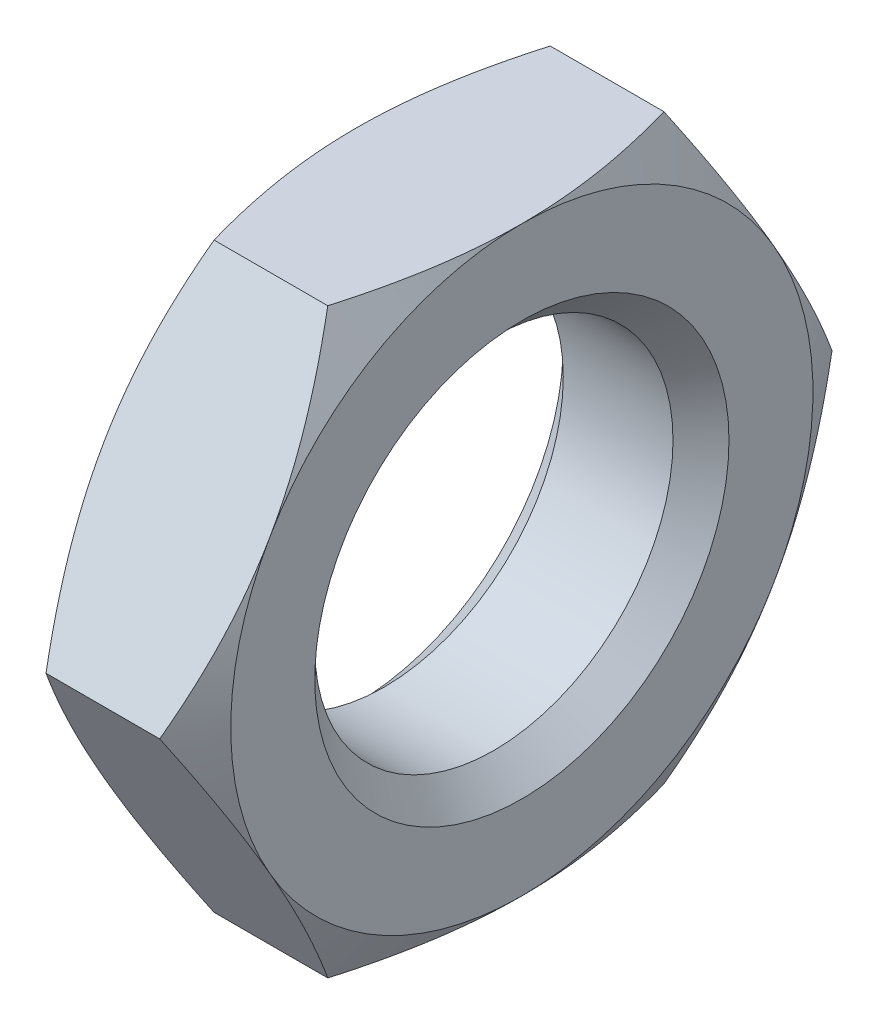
SolidWorks part; units mm, degrees
ref_plane "Front Plane" through (0, 0, 0) normal (0, 0, 1) x (1, 0, 0)
ref_plane "Top Plane" through (0, 0, 0) normal (0, 1, 0) x (1, 0, 0)
ref_plane "Right Plane" through (0, 0, 0) normal (1, 0, 0) x (0, 0, -1)
sketch "Sketch1" plane through (0, 0, 0) normal (1, 0, 0) x (0, 0, -1)
  line L1 (3.7528, 6.5) -> (-3.7528, 6.5)
  line L2 (-3.7528, 6.5) -> (-7.5056, 0)
  line L3 (-7.5056, 0) -> (-3.7528, -6.5)
  line L4 (-3.7528, -6.5) -> (3.7528, -6.5)
  line L5 (3.7528, -6.5) -> (7.5056, 0)
  line L6 (7.5056, 0) -> (3.7528, 6.5)
  circle A0 centre (0, 0) radius 6.5 construction
  circle A1 centre (0, 0) radius 4
extrude "Extrude1" add sketch "Sketch1" along normal blind 3.7
sketch "Sketch2" plane through (0, 0, 0) normal (0, 0, 1) x (1, 0, 0)
  line L0 (3.7, 6.5) -> (3.7, 26)
  line L1 (3.7, 26) -> (0, 26)
  line L2 (0, 26) -> (0, 6.5)
  line L3 (0, 6.5) -> (1.85, 9.7043)
  line L4 (1.85, 9.7043) -> (3.7, 6.5)
revolve "Cut-Revolve1" cut sketch "Sketch2" angle 360 about axis through (3.7, 0, 0) along (-1, 0, 0)
chamfer "Chamfer1" distance 0.625 angle 45 2 edges at (0, 0, -4) (3.7, 0, -4)
equation "\"D2@Sketch2\"=\"D1@Sketch1\"*2"
